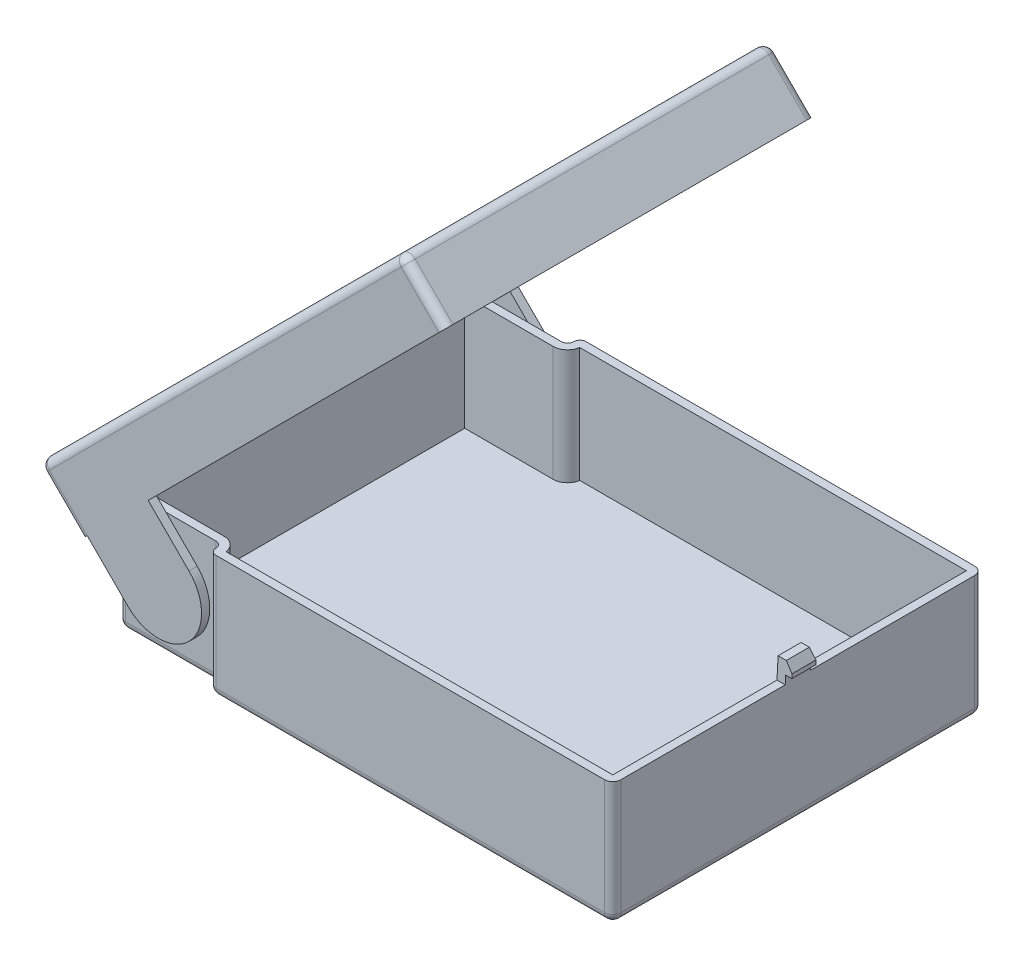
SolidWorks part; units mm, degrees
other "<Figure 11-59>-<Mirror5>"
ref_plane "Front Plane" through (0, 0, 0) normal (0, 0, 1) x (1, 0, 0)
ref_plane "Top Plane" through (0, 0, 0) normal (0, 1, 0) x (1, 0, 0)
ref_plane "Right Plane" through (0, 0, 0) normal (1, 0, 0) x (0, 0, -1)
sketch "Sketch1" plane through (0, 0, 0) normal (0, 1, 0) x (1, 0, 0)
  line L0 (-36.5, 45) -> (-36.5, 42)
  line L1 (-36.5, -45) -> (61.5, -45)
  line L2 (-61.5, -42) -> (-61.5, 42)
  line L3 (-36.5, 45) -> (61.5, 45)
  line L4 (61.5, -45) -> (61.5, 45)
  line L5 (-36.5, 42) -> (-61.5, 42)
  line L6 (-61.5, 0) -> (61.5, 0) construction
  line L8 (-36.5, -42) -> (-61.5, -42)
  line L9 (-36.5, -45) -> (-36.5, -42)
  dimension "D1" = 123
  dimension "D2" = 3
  dimension "D3" = 90
  dimension "D4" = 25
extrude "Extrude1" add sketch "Sketch1" along normal blind 30
fillet "Fillet1" radius 1.5
fillet "Fillet3" radius 2
fillet "Fillet2" radius 2
shell "Shell1" thickness 2
sketch "Sketch2" plane through (0, 0, 42) normal (0, 0, 1) x (1, 0, 0)
  line L0 (-60, 30) -> (-38, 2) construction
  circle A0 centre (-49, 16) radius 1.25
  dimension "D1" = 2.5
extrude "Extrude2" add sketch "Sketch2" along normal blind 2
mirror "Mirror1" about plane through (0, 0, 0) normal (0, 0, 1) of "Extrude2"
sketch3d "3DSketch1"
  point P0 (61.5, 30, 0)
other "Snap Hook1" parameters "BaseDepth"=2, "TopDepth"=2, "Width"=5.6, "HookHeight"=3, "Overhang"=1.5, "BodyHeight"=2, "Draft"=3, "LipHeight"=1
inserted part "Figure 11-59"
move or copy body "Body-Move/Copy2" placed by mates yes
other "SnapGroove1" parameters "HeightOffset"=0, "WidthOffset"=0, "Clearance"=0, "Gap"=0, "GapHeight"=2
move or copy body "Body-Move/Copy3" bodies to move or copy 104 copy no rotation origin (-49, 16, 0) rotation axis (0, 0, 1) rotation angle 45
delete or keep bodies "Body-Delete1" type delete bodies bodies 103
